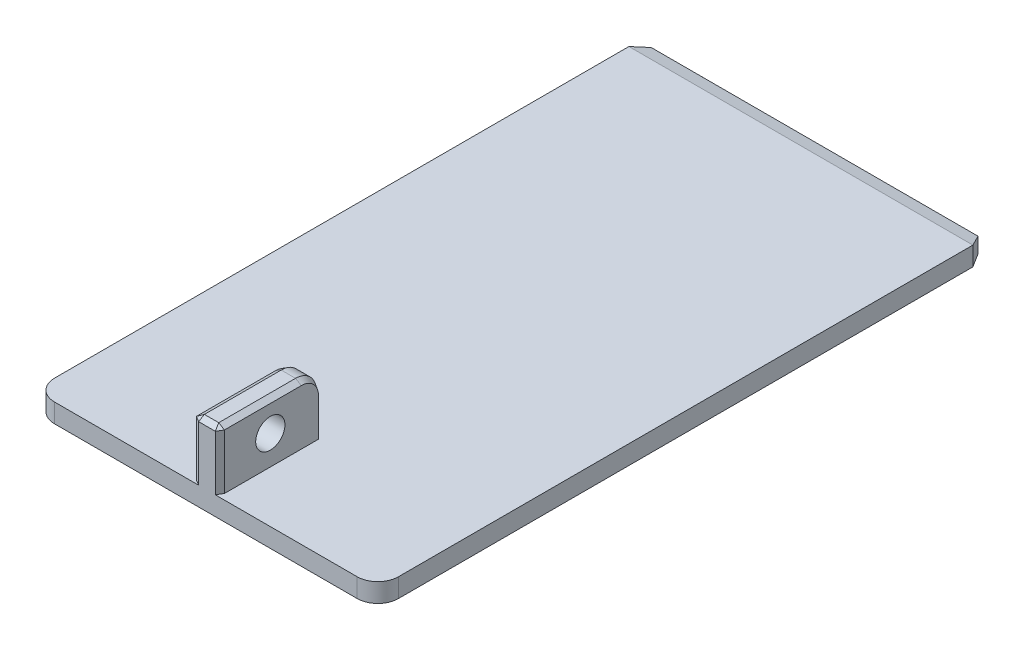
SolidWorks part; units mm, degrees
ref_plane "Ebene vorne" through (0, 0, 0) normal (0, 0, 1) x (1, 0, 0)
ref_plane "Ebene oben" through (0, 0, 0) normal (0, 1, 0) x (1, 0, 0)
ref_plane "Ebene rechts" through (0, 0, 0) normal (1, 0, 0) x (0, 0, -1)
sketch "Skizze1" plane through (0, 0, 0) normal (0, 0, 1) x (1, 0, 0)
  line L1 (-50, 2.75) -> (50, 2.75)
  line L2 (-50, 2.75) -> (-50, -2.75)
  line L3 (-50, -2.75) -> (50, -2.75)
  line L4 (50, 2.75) -> (50, -2.75)
  line L5 (-50, 2.75) -> (50, -2.75) construction
  line L6 (-50, -2.75) -> (50, 2.75) construction
  point P0 (0, 0)
  dimension "D1" = 100
  dimension "D2" = 5.5
extrude "Aufsatz-Linear austragen1" add sketch "Skizze1" along normal blind 177
chamfer "Fase1" distance 2.5 distance2 4 2 edges at (-50, 0, 0) (50, 0, 0)
chamfer "Fase2" distance 1 distance2 4 1 edges at (0, 2.75, 0)
sketch "Skizze2" plane through (0, 2.75, 0) normal (0, 1, 0) x (1, 0, 0)
  line L0 (0, -177) -> (0, -85.1947) construction
  line L1 (50, -177) -> (-50, -177) construction
  line L2 (-3.75, -177) -> (-3.75, -147)
  line L3 (-3.75, -147) -> (3.75, -147)
  line L4 (3.75, -177) -> (3.75, -147)
  line L5 (3.75, -177) -> (-3.75, -177)
  point P9 (0, -147)
  dimension "D1" = 7.5
  dimension "D2" = 30
extrude "Aufsatz-Linear austragen2" add sketch "Skizze2" along normal blind 17
sketch "Skizze3" plane through (3.75, 0, 0) normal (1, 0, 0) x (0, 0, -1)
  line L0 (-177, 11.25) -> (-147, 11.25) construction
  line L1 (-177, 19.75) -> (-177, 2.75) construction
  line L2 (-147, 19.75) -> (-147, 2.75) construction
  circle A0 centre (-162, 11.25) radius 4.25
  dimension "D1" = 8.5
  dimension "D2" = 15
extrude "Schnitt-Linear austragen1" cut sketch "Skizze3" against normal through all
fillet "Verrundung1" radius 6 1 edges at (0, 19.75, 147)
fillet "Verrundung2" radius 6 2 edges at (-50, 0, 177) (50, 0, 177)
chamfer "Fase3" distance 1 angle 59 9 edges at (3.75, 8.25, 147) (3.75, 17.9926, 148.7574) (3.75, 19.75, 165) (-3.75, 8.25, 147) (-3.75, 17.9926, 148.7574) (-3.75, 19.75, 165) (0, 19.75, 177) (3.75, 11.25, 177) (-3.75, 11.25, 177)
